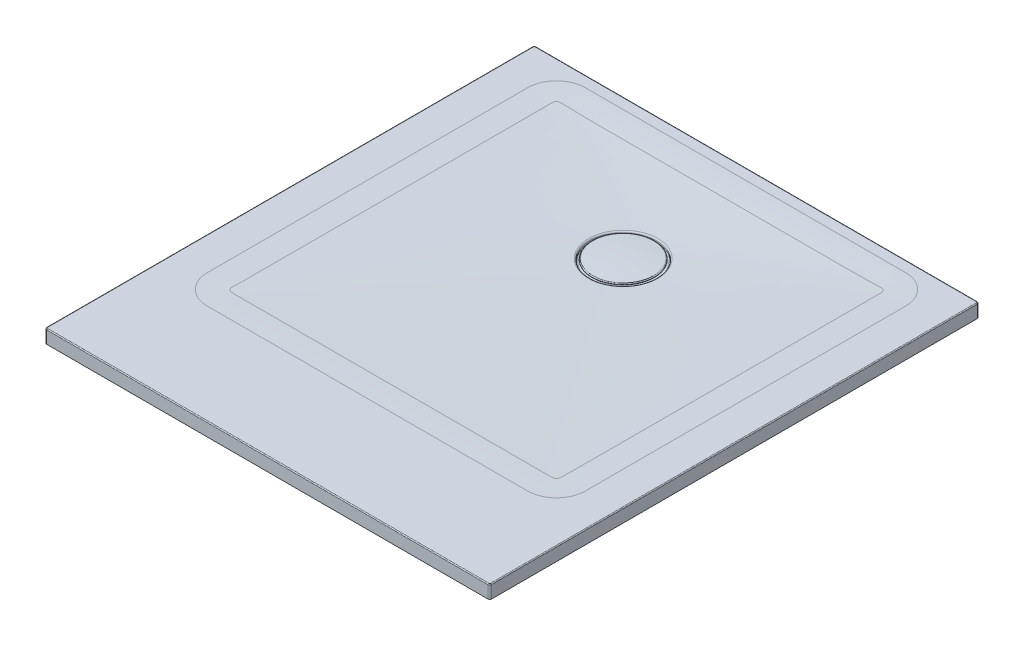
SolidWorks part; units mm, degrees
ref_plane "Płaszczyzna przednia" through (0, 0, 0) normal (0, 0, 1) x (1, 0, 0)
ref_plane "Płaszczyzna górna" through (0, 0, 0) normal (0, 1, 0) x (1, 0, 0)
ref_plane "Płaszczyzna prawa" through (0, 0, 0) normal (1, 0, 0) x (0, 0, -1)
sketch "Szkic2" plane through (0, 0, 0) normal (0, 1, 0) x (1, 0, 0)
  line L0 (0, 550) -> (0, 250) construction
  line L1 (-500, -550) -> (500, -550)
  line L2 (-500, -550) -> (-500, 550)
  line L3 (-500, 550) -> (500, 550)
  line L4 (500, -550) -> (500, 550)
  line L5 (-500, -550) -> (500, 550) construction
  line L6 (-500, 550) -> (500, -550) construction
  line L7 (-410, 510) -> (410, 510)
  line L8 (-410, 510) -> (-410, -310)
  line L9 (-410, -310) -> (410, -310)
  line L10 (410, 510) -> (410, -310)
  line L11 (-450, 550) -> (-450, -350) construction
  line L12 (-450, -350) -> (450, -350) construction
  line L13 (450, -350) -> (450, 550) construction
  circle A0 centre (0, 250) radius 75
  point P0 (0, 0)
  point P11 (0, 510)
  point P16 (0, -350)
  dimension "D9" = 150
  dimension "D1" = 1000
  dimension "D2" = 1100
  dimension "D3" = 40
  dimension "D4" = 90
  dimension "D5" = 40
  dimension "D6" = 50
  dimension "D7" = 900
  dimension "D8" = 300
  dimension "D10" = 900
sketch "Szkic3" plane through (0, 0, 0) normal (0, 1, 0) x (1, 0, 0)
  line L0 (-500, -550) -> (-500, 550) construction
  line L1 (-500, -550) -> (500, -550) construction
  line L2 (500, -550) -> (500, 550) construction
  line L3 (-500, 550) -> (500, 550) construction
  line L4 (-410, 510) -> (-410, -310) construction
  line L5 (-410, 510) -> (410, 510) construction
  line L6 (410, 510) -> (410, -310) construction
  line L7 (-410, -310) -> (410, -310) construction
  line L8 (-500, -550) -> (-500, 550)
  line L9 (-500, -550) -> (500, -550)
  line L10 (500, -550) -> (500, 550)
  line L11 (-500, 550) -> (500, 550)
  line L12 (-410, 460) -> (-410, -260)
  line L13 (-360, 510) -> (360, 510)
  line L14 (410, 460) -> (410, -260)
  line L15 (-360, -310) -> (360, -310)
  arc A0 (410, 460) -> (360, 510) centre (360, 460) ccw
  arc A1 (-360, 510) -> (-410, 460) centre (-360, 460) ccw
  arc A2 (360, -310) -> (410, -260) centre (360, -260) ccw
  arc A3 (-360, -310) -> (-410, -260) centre (-360, -260) cw
  dimension "D1" = 50
surface "Powierzchnia-Płaszczyzna1" sketch "Szkic3"
sketch "Szkic4" plane through (0, 0, 0) normal (0, 1, 0) x (1, 0, 0)
  line L0 (-410, 510) -> (-410, -310) construction
  line L1 (-410, -310) -> (410, -310) construction
  line L2 (410, 510) -> (410, -310) construction
  line L3 (-410, 510) -> (410, 510) construction
  line L4 (-410, 510) -> (-410, -310)
  line L5 (-410, -310) -> (410, -310)
  line L6 (410, 510) -> (410, -310)
  line L7 (-410, 510) -> (410, 510)
ref_plane "korek" through (0, -15, 0) normal (0, 1, 0) x (-1, 0, 0)
sketch "Szkic5" plane through (0, -15, 0) normal (0, 1, 0) x (-1, 0, 0)
  circle A0 centre (0, -250) radius 75 construction
  circle A1 centre (0, -250) radius 75
surface "Powierzchnia-Wyciągnięcie po profilach2"
surface "Powierzchnia-Połącz1"
sketch "Szkic7" plane through (0, 0, 0) normal (0, 1, 0) x (1, 0, 0)
  line L27 (360, 470) -> (-360, 470)
  line L28 (-370, 460) -> (-370, -260)
  line L29 (-360, -270) -> (360, -270)
  line L30 (370, -260) -> (370, 460)
  line L31 (360, 470) -> (-360, 470)
  line L32 (-370, 460) -> (-370, -260)
  line L33 (-360, -270) -> (360, -270)
  line L34 (370, -260) -> (370, 460)
  line L35 (360, 525) -> (-360, 525)
  line L36 (-425, 460) -> (-425, -260)
  line L37 (-360, -325) -> (360, -325)
  line L38 (425, -260) -> (425, 460)
  line L39 (360, 525) -> (-360, 525)
  line L40 (-425, 460) -> (-425, -260)
  line L41 (-360, -325) -> (360, -325)
  line L42 (425, -260) -> (425, 460)
  arc A0 (370, -260) -> (360, -270) centre (360, -260) cw
  arc A1 (-370, -260) -> (-360, -270) centre (-360, -260) ccw
  arc A2 (370, 460) -> (360, 470) centre (360, 460) ccw
  arc A3 (-370, 460) -> (-360, 470) centre (-360, 460) cw
  spline S23 degree 3 poles (-592.8534, 189.9822) (199.2349, 360.9181) (376.7211, 427.1416) (369.745, 462.2678) (369.666, 462.5845) (369.4754, 463.2124) (369.364, 463.5246) (368.988, 464.4324) (368.6811, 465.0065) (368.1375, 465.8215) (367.9415, 466.0862) (367.5237, 466.5957) (367.3038, 466.8382) (366.6124, 467.53) (366.1095, 467.944) (365.2905, 468.4922) (365.0067, 468.6626) (364.4299, 468.9712) (364.1354, 469.1107) (363.5342, 469.3603) (363.2277, 469.4705) (362.6023, 469.6611) (362.282, 469.7415) (264.9375, 489.2875) (3.1224, -972.5106) (173.7168, 1452.4895) knots -6.686616 -6.686616 -6.686616 -6.686616 0.125 0.125 0.1875 0.1875 0.25 0.25 0.375 0.375 0.4375 0.4375 0.5 0.5 0.625 0.625 0.6875 0.6875 0.75 0.75 0.8125 0.8125 0.875 0.875 19.654836 19.654836 19.654836 19.654836 only from (370, 460) to (360, 470)
  spline S24 degree 3 poles (-70.7868, -487.2634) (-234.1078, 220.8885) (-320.6277, 478.0564) (-362.2675, 469.7447) (-362.5843, 469.6659) (-363.2122, 469.4758) (-363.5243, 469.3641) (-364.4322, 468.9881) (-365.0063, 468.6812) (-365.8213, 468.1376) (-366.086, 467.9416) (-366.5956, 467.5238) (-366.838, 467.3039) (-367.5299, 466.6127) (-367.9438, 466.1098) (-368.4921, 465.2907) (-368.6624, 465.0069) (-368.9711, 464.4301) (-369.1106, 464.1356) (-369.3602, 463.5345) (-369.4701, 463.2278) (-369.6611, 462.6026) (-369.7417, 462.2823) (-378.4448, 418.7179) (-98.9299, 343.4574) (601.124, 221.4675) knots -7.963341 -7.963341 -7.963341 -7.963341 0.125 0.125 0.1875 0.1875 0.25 0.25 0.375 0.375 0.4375 0.4375 0.5 0.5 0.625 0.625 0.6875 0.6875 0.75 0.75 0.8125 0.8125 0.875 0.875 9.242707 9.242707 9.242707 9.242707 only from (-360, 470) to (-370, 460)
  spline S25 degree 3 poles (592.8533, 10.0177) (-199.2349, -160.9181) (-376.7211, -227.1416) (-369.745, -262.2678) (-369.666, -262.5845) (-369.4754, -263.2124) (-369.364, -263.5246) (-368.988, -264.4324) (-368.6811, -265.0065) (-368.1375, -265.8215) (-367.9415, -266.0862) (-367.5237, -266.5957) (-367.3038, -266.8382) (-366.6124, -267.53) (-366.1095, -267.944) (-365.2905, -268.4922) (-365.0067, -268.6626) (-364.4299, -268.9712) (-364.1354, -269.1107) (-363.5342, -269.3603) (-363.2277, -269.4705) (-362.6023, -269.6611) (-362.282, -269.7415) (-264.9375, -289.2875) (-3.1224, 1172.5106) (-173.7167, -1252.4896) knots -6.686616 -6.686616 -6.686616 -6.686616 0.125 0.125 0.1875 0.1875 0.25 0.25 0.375 0.375 0.4375 0.4375 0.5 0.5 0.625 0.625 0.6875 0.6875 0.75 0.75 0.8125 0.8125 0.875 0.875 19.654836 19.654836 19.654836 19.654836 only from (-370, -260) to (-360, -270)
  spline S26 degree 3 poles (70.7867, 687.2638) (234.1078, -20.8885) (320.6277, -278.0564) (362.2675, -269.7447) (362.5843, -269.6659) (363.2122, -269.4758) (363.5243, -269.3641) (364.4322, -268.9881) (365.0063, -268.6812) (365.8213, -268.1376) (366.086, -267.9416) (366.5956, -267.5238) (366.838, -267.3039) (367.5299, -266.6127) (367.9438, -266.1098) (368.4921, -265.2907) (368.6624, -265.0069) (368.9711, -264.4301) (369.1106, -264.1356) (369.3602, -263.5345) (369.4701, -263.2278) (369.6611, -262.6026) (369.7417, -262.2823) (378.4448, -218.7179) (98.9299, -143.4574) (-601.1242, -21.4674) knots -7.963341 -7.963341 -7.963341 -7.963341 0.125 0.125 0.1875 0.1875 0.25 0.25 0.375 0.375 0.4375 0.4375 0.5 0.5 0.625 0.625 0.6875 0.6875 0.75 0.75 0.8125 0.8125 0.875 0.875 9.242707 9.242707 9.242707 9.242707 only from (360, -270) to (370, -260)
  spline S31 degree 3 poles (-2397.6876, -514.0327) (-135.4247, 39.9522) (456.1742, 309.4399) (423.3423, 474.7392) (422.8284, 476.7976) (421.9012, 479.8586) (421.5656, 480.8762) (420.8439, 482.8948) (420.4595, 483.891) (418.4226, 488.8086) (416.4282, 492.5404) (413.4834, 496.9548) (412.8716, 497.825) (411.6017, 499.5398) (410.9419, 500.3865) (408.905, 502.8707) (407.476, 504.4469) (402.9824, 508.9436) (399.7133, 511.6343) (395.2771, 514.6046) (394.3696, 515.1804) (392.5351, 516.2815) (391.6077, 516.8075) (388.7956, 518.3124) (386.8811, 519.219) (382.9737, 520.8415) (380.9808, 521.5575) (377.932, 522.4866) (376.9058, 522.7721) (374.8331, 523.2938) (373.7847, 523.5304) (370.6359, 524.16) (368.5249, 524.4736) (210.4434, 540.1075) (-7.5467, -2.6087) (-426.7383, -2355.6859) knots -4.789679 -4.789679 -4.789679 -4.789679 0.125 0.125 0.1875 0.1875 0.21875 0.21875 0.25 0.25 0.375 0.375 0.40625 0.40625 0.4375 0.4375 0.5 0.5 0.625 0.625 0.65625 0.65625 0.6875 0.6875 0.75 0.75 0.8125 0.8125 0.84375 0.84375 0.875 0.875 0.9375 0.9375 5.529891 5.529891 5.529891 5.529891 only from (425, 460) to (360, 525)
  spline S32 degree 3 poles (552.1182, -2320.313) (-3.2884, 91.1965) (-224.1461, 538.7123) (-368.4945, 524.4772) (-370.5876, 524.1672) (-374.7388, 523.3421) (-376.7972, 522.8284) (-379.8582, 521.9015) (-380.8757, 521.5658) (-382.8943, 520.844) (-383.8906, 520.4597) (-388.8083, 518.4228) (-392.5401, 516.4283) (-396.9545, 513.4836) (-397.8247, 512.8718) (-399.5395, 511.6019) (-400.3863, 510.9421) (-402.8704, 508.9052) (-404.4466, 507.4761) (-408.9434, 502.9826) (-411.6341, 499.7136) (-414.6044, 495.2774) (-415.1802, 494.3699) (-416.2814, 492.5354) (-416.8072, 491.608) (-418.3122, 488.7958) (-419.2188, 486.8813) (-420.8414, 482.974) (-421.5571, 480.981) (-422.4865, 477.9323) (-422.7722, 476.9062) (-423.2939, 474.8335) (-423.5305, 473.7851) (-462.445, 279.0157) (388.5872, -13.5286) (2421.1122, -437.3032) knots -4.149831 -4.149831 -4.149831 -4.149831 0.0625 0.0625 0.125 0.125 0.1875 0.1875 0.21875 0.21875 0.25 0.25 0.375 0.375 0.40625 0.40625 0.4375 0.4375 0.5 0.5 0.625 0.625 0.65625 0.65625 0.6875 0.6875 0.75 0.75 0.8125 0.8125 0.84375 0.84375 0.875 0.875 6.642368 6.642368 6.642368 6.642368 only from (-360, 525) to (-425, 460)
  spline S33 degree 3 poles (2397.6877, 714.0327) (135.4247, 160.0478) (-456.1742, -109.4399) (-423.3423, -274.7392) (-422.8284, -276.7976) (-421.9012, -279.8586) (-421.5656, -280.8762) (-420.8439, -282.8948) (-420.4595, -283.891) (-418.4226, -288.8086) (-416.4282, -292.5404) (-413.4834, -296.9548) (-412.8716, -297.825) (-411.6017, -299.5398) (-410.9419, -300.3865) (-408.905, -302.8707) (-407.476, -304.4469) (-402.9824, -308.9436) (-399.7133, -311.6343) (-395.2771, -314.6046) (-394.3696, -315.1804) (-392.5351, -316.2815) (-391.6077, -316.8075) (-388.7956, -318.3124) (-386.8811, -319.219) (-382.9737, -320.8415) (-380.9808, -321.5575) (-377.932, -322.4866) (-376.9058, -322.7721) (-374.8331, -323.2938) (-373.7847, -323.5304) (-370.6359, -324.16) (-368.5249, -324.4736) (-210.4434, -340.1075) (7.5467, 202.6087) (426.7383, 2555.6859) knots -4.789679 -4.789679 -4.789679 -4.789679 0.125 0.125 0.1875 0.1875 0.21875 0.21875 0.25 0.25 0.375 0.375 0.40625 0.40625 0.4375 0.4375 0.5 0.5 0.625 0.625 0.65625 0.65625 0.6875 0.6875 0.75 0.75 0.8125 0.8125 0.84375 0.84375 0.875 0.875 0.9375 0.9375 5.529891 5.529891 5.529891 5.529891 only from (-425, -260) to (-360, -325)
  spline S34 degree 3 poles (-552.1181, 2520.3129) (3.2884, 108.8035) (224.1461, -338.7123) (368.4945, -324.4772) (370.5876, -324.1672) (374.7388, -323.3421) (376.7972, -322.8284) (379.8582, -321.9015) (380.8757, -321.5658) (382.8943, -320.844) (383.8906, -320.4597) (388.8083, -318.4228) (392.5401, -316.4283) (396.9545, -313.4836) (397.8247, -312.8718) (399.5395, -311.6019) (400.3863, -310.9421) (402.8704, -308.9052) (404.4466, -307.4761) (408.9434, -302.9826) (411.6341, -299.7136) (414.6044, -295.2774) (415.1802, -294.3699) (416.2814, -292.5354) (416.8072, -291.608) (418.3122, -288.7958) (419.2188, -286.8813) (420.8414, -282.974) (421.5571, -280.981) (422.4865, -277.9323) (422.7722, -276.9062) (423.2939, -274.8335) (423.5305, -273.7851) (462.445, -79.0157) (-388.5872, 213.5286) (-2421.1122, 637.3032) knots -4.149831 -4.149831 -4.149831 -4.149831 0.0625 0.0625 0.125 0.125 0.1875 0.1875 0.21875 0.21875 0.25 0.25 0.375 0.375 0.40625 0.40625 0.4375 0.4375 0.5 0.5 0.625 0.625 0.65625 0.65625 0.6875 0.6875 0.75 0.75 0.8125 0.8125 0.84375 0.84375 0.875 0.875 6.642368 6.642368 6.642368 6.642368 only from (360, -325) to (425, -260)
  spline S35 degree 3 poles (425, 460) (425, 464.2918) (424.5791, 468.512) (423.3423, 474.7392) (422.8284, 476.7976) (421.9012, 479.8586) (421.5656, 480.8762) (420.8439, 482.8948) (420.4595, 483.891) (418.4226, 488.8086) (416.4282, 492.5404) (413.4834, 496.9548) (412.8716, 497.825) (411.6017, 499.5398) (410.9419, 500.3865) (408.905, 502.8707) (407.476, 504.4469) (402.9824, 508.9436) (399.7133, 511.6343) (395.2771, 514.6046) (394.3696, 515.1804) (392.5351, 516.2815) (391.6077, 516.8075) (388.7956, 518.3124) (386.8811, 519.219) (382.9737, 520.8415) (380.9808, 521.5575) (377.932, 522.4866) (376.9058, 522.7721) (374.8331, 523.2938) (373.7847, 523.5304) (370.6359, 524.16) (368.5249, 524.4736) (364.2799, 524.8935) (362.1458, 525) (360, 525) knots 0 0 0 0 0.125 0.125 0.1875 0.1875 0.21875 0.21875 0.25 0.25 0.375 0.375 0.40625 0.40625 0.4375 0.4375 0.5 0.5 0.625 0.625 0.65625 0.65625 0.6875 0.6875 0.75 0.75 0.8125 0.8125 0.84375 0.84375 0.875 0.875 0.9375 0.9375 1 1 1 1
  spline S36 degree 3 poles (-360, 525) (-362.1459, 525) (-364.2736, 524.8935) (-368.4945, 524.4772) (-370.5876, 524.1672) (-374.7388, 523.3421) (-376.7972, 522.8284) (-379.8582, 521.9015) (-380.8757, 521.5658) (-382.8943, 520.844) (-383.8906, 520.4597) (-388.8083, 518.4228) (-392.5401, 516.4283) (-396.9545, 513.4836) (-397.8247, 512.8718) (-399.5395, 511.6019) (-400.3863, 510.9421) (-402.8704, 508.9052) (-404.4466, 507.4761) (-408.9434, 502.9826) (-411.6341, 499.7136) (-414.6044, 495.2774) (-415.1802, 494.3699) (-416.2814, 492.5354) (-416.8072, 491.608) (-418.3122, 488.7958) (-419.2188, 486.8813) (-420.8414, 482.974) (-421.5571, 480.981) (-422.4865, 477.9323) (-422.7722, 476.9062) (-423.2939, 474.8335) (-423.5305, 473.7851) (-424.5791, 468.5368) (-425, 464.2918) (-425, 460) knots 0 0 0 0 0.0625 0.0625 0.125 0.125 0.1875 0.1875 0.21875 0.21875 0.25 0.25 0.375 0.375 0.40625 0.40625 0.4375 0.4375 0.5 0.5 0.625 0.625 0.65625 0.65625 0.6875 0.6875 0.75 0.75 0.8125 0.8125 0.84375 0.84375 0.875 0.875 1 1 1 1
  spline S37 degree 3 poles (-425, -260) (-425, -264.2918) (-424.5791, -268.512) (-423.3423, -274.7392) (-422.8284, -276.7976) (-421.9012, -279.8586) (-421.5656, -280.8762) (-420.8439, -282.8948) (-420.4595, -283.891) (-418.4226, -288.8086) (-416.4282, -292.5404) (-413.4834, -296.9548) (-412.8716, -297.825) (-411.6017, -299.5398) (-410.9419, -300.3865) (-408.905, -302.8707) (-407.476, -304.4469) (-402.9824, -308.9436) (-399.7133, -311.6343) (-395.2771, -314.6046) (-394.3696, -315.1804) (-392.5351, -316.2815) (-391.6077, -316.8075) (-388.7956, -318.3124) (-386.8811, -319.219) (-382.9737, -320.8415) (-380.9808, -321.5575) (-377.932, -322.4866) (-376.9058, -322.7721) (-374.8331, -323.2938) (-373.7847, -323.5304) (-370.6359, -324.16) (-368.5249, -324.4736) (-364.2799, -324.8935) (-362.1458, -325) (-360, -325) knots 0 0 0 0 0.125 0.125 0.1875 0.1875 0.21875 0.21875 0.25 0.25 0.375 0.375 0.40625 0.40625 0.4375 0.4375 0.5 0.5 0.625 0.625 0.65625 0.65625 0.6875 0.6875 0.75 0.75 0.8125 0.8125 0.84375 0.84375 0.875 0.875 0.9375 0.9375 1 1 1 1
  spline S38 degree 3 poles (360, -325) (362.1459, -325) (364.2736, -324.8935) (368.4945, -324.4772) (370.5876, -324.1672) (374.7388, -323.3421) (376.7972, -322.8284) (379.8582, -321.9015) (380.8757, -321.5658) (382.8943, -320.844) (383.8906, -320.4597) (388.8083, -318.4228) (392.5401, -316.4283) (396.9545, -313.4836) (397.8247, -312.8718) (399.5395, -311.6019) (400.3863, -310.9421) (402.8704, -308.9052) (404.4466, -307.4761) (408.9434, -302.9826) (411.6341, -299.7136) (414.6044, -295.2774) (415.1802, -294.3699) (416.2814, -292.5354) (416.8072, -291.608) (418.3122, -288.7958) (419.2188, -286.8813) (420.8414, -282.974) (421.5571, -280.981) (422.4865, -277.9323) (422.7722, -276.9062) (423.2939, -274.8335) (423.5305, -273.7851) (424.5791, -268.5368) (425, -264.2918) (425, -260) knots 0 0 0 0 0.0625 0.0625 0.125 0.125 0.1875 0.1875 0.21875 0.21875 0.25 0.25 0.375 0.375 0.40625 0.40625 0.4375 0.4375 0.5 0.5 0.625 0.625 0.65625 0.65625 0.6875 0.6875 0.75 0.75 0.8125 0.8125 0.84375 0.84375 0.875 0.875 1 1 1 1
  dimension "D3" = 10
  dimension "D1" = 40
  dimension "D2" = 15
other "Usuń ścianę1"
other "Granica-Powierzchnia1"
surface "Powierzchnia-Połącz2"
sketch "Szkic9" plane through (0, 0, 0) normal (0, 1, 0) x (1, 0, 0)
  line L0 (-500, -550) -> (500, -550) construction
  line L1 (-500, -550) -> (-500, 550) construction
  line L2 (500, -550) -> (500, 550) construction
  line L3 (-500, 550) -> (500, 550) construction
  line L4 (-500, -550) -> (500, -550)
  line L5 (-500, -550) -> (-500, 550)
  line L6 (500, -550) -> (500, 550)
  line L7 (-500, 550) -> (500, 550)
surface "Powierzchnia-Wyciągnięcie1" sketch "Szkic9" parameters "D1"=30
sketch "Szkic8" plane through (0, 0, 0) normal (1, 0, 0) x (0, 0, -1)
  line L0 (250, 0) -> (250, -30) construction
  line L1 (174.9999, -15) -> (175.2968, -23.5)
  line L4 (175.2968, -23.5) -> (198, -24.0945)
  line L5 (175.2968, -23.5) -> (250, -23.5) construction
  line L6 (198, -24.0945) -> (198, -30) construction
  line L7 (250, -30) -> (175.2968, -30) construction
  line L8 (175.2968, -30) -> (175.2968, -23.5) construction
  line L9 (205, -28) -> (205, -30)
  line L10 (198, -24.0945) -> (205, -28)
  dimension "D1" = 30
  dimension "D2" = 8.5
  dimension "D3" = 2
  dimension "D4" = 1.5
  dimension "D5" = 52
  dimension "D6" = 45
  dimension "D7" = 2
surface "Powierzchnia-Obrót1" sketch "Szkic8" parameters "D1"=360
surface "Powierzchnia-Płaszczyzna2"
surface "Powierzchnia-Połącz3"
fillet "Zaokrąglenie4" radius 4 4 edges at (-500, -15, -550) (500, -15, -550) (-500, -15, 550) (500, -15, 550)
fillet "Zaokrąglenie5" radius 3 3 edges at (0, -24.0945, -302) (0, -23.5, -324.7032)
fillet "Zaokrąglenie6" radius 2 9 edges at (498.8284, 0, 548.8284) (0, 0, 550) (-498.8284, 0, 548.8284) (-500, 0, 0) (-498.8284, 0, -548.8284) (0, 0, -550) (498.8284, 0, -548.8284) (500, 0, 0) (0, -28, -295)
sketch "Szkic11" plane through (0, 0, 0) normal (1, 0, 0) x (0, 0, -1)
  line L0 (250, 0) -> (250, -30) construction
  line L1 (-546, -30) -> (546, -30) construction
  line L2 (250, -17) -> (250, -11.5)
  line L14 (320, -11.5) -> (320, -14.5) construction
  line L16 (320, -17) -> (250, -17)
  line L18 (320, -17) -> (320, -16.3377)
  line L19 (250, -11.5) -> (320, -11.5) construction
  arc A0 (320, -16.3377) -> (318.1666, -14.3446) centre (318, -16.3377) ccw
  arc A6 (318.1666, -14.3446) -> (250, -11.5) centre (250, -829.6667) ccw
  dimension "D2" = 2
  dimension "D8" = 2.5
  dimension "D9" = 17
  dimension "D10" = 5.5
  dimension "D11" = 70
revolve "Obrót1" add sketch "Szkic11" angle 360 about L0
